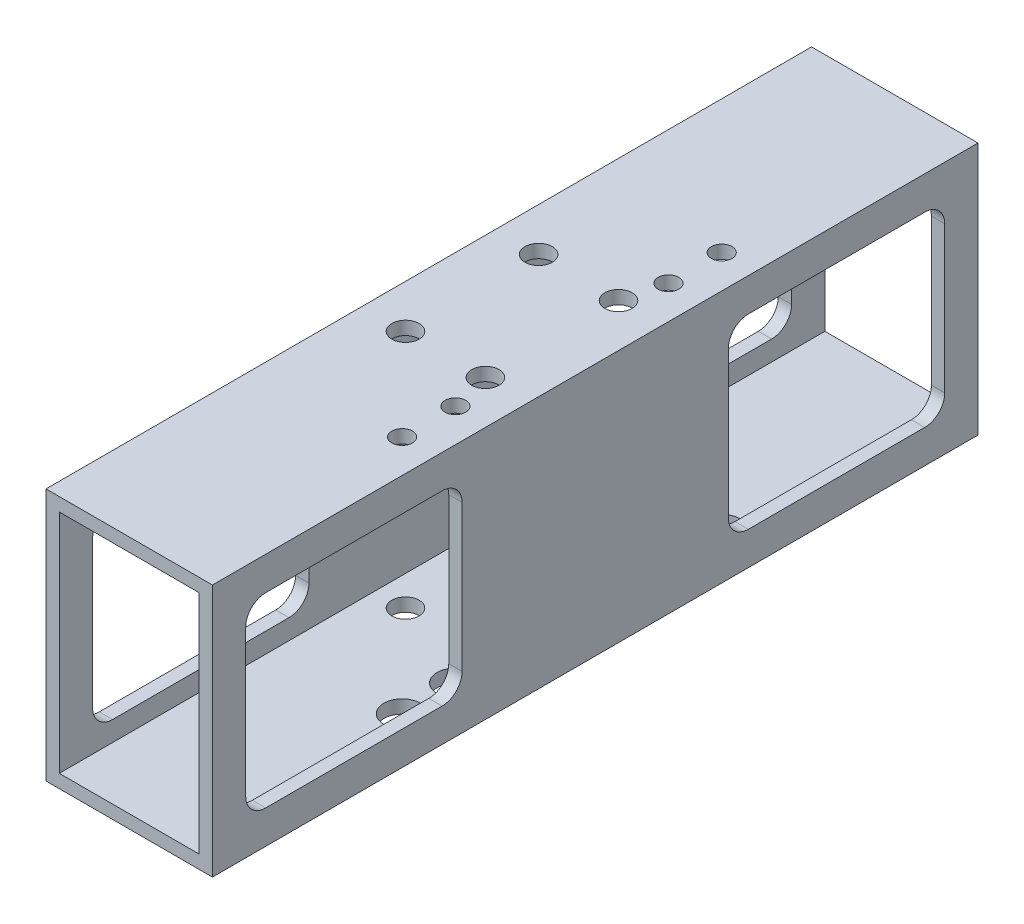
SolidWorks part; units mm, degrees
ref_plane "前视基准面" through (0, 0, 0) normal (0, 0, 1) x (1, 0, 0)
ref_plane "上视基准面" through (0, 0, 0) normal (0, 1, 0) x (1, 0, 0)
ref_plane "右视基准面" through (0, 0, 0) normal (1, 0, 0) x (0, 0, -1)
sketch "草图1" plane through (0, 0, 0) normal (0, 0, 1) x (1, 0, 0)
  line L0 (-10.5, 17) -> (10.5, 17)
  line L1 (-12.5, -19) -> (12.5, -19)
  line L2 (-12.5, -19) -> (-12.5, 19)
  line L3 (-12.5, 19) -> (12.5, 19)
  line L4 (12.5, -19) -> (12.5, 19)
  line L5 (-12.5, -19) -> (12.5, 19) construction
  line L6 (-12.5, 19) -> (12.5, -19) construction
  line L7 (10.5, -17) -> (10.5, 17)
  line L8 (-10.5, -17) -> (10.5, -17)
  line L9 (-10.5, -17) -> (-10.5, 17)
  point P0 (0, 0)
  dimension "D1" = 38
  dimension "D2" = 25
  dimension "D3" = 2
extrude "凸台-拉伸1" add sketch "草图1" along normal blind 115
sketch "草图2" plane through (0, 19, 0) normal (0, 1, 0) x (1, 0, 0)
  line L0 (0, 0) -> (0, -115) construction
  line L1 (12.5, -115) -> (-12.5, -115) construction
  line L2 (-12.5, -57.5) -> (12.5, -57.5) construction
  line L3 (-12.5, -115) -> (-12.5, 0) construction
  line L4 (12.5, -115) -> (12.5, 0) construction
  circle A0 centre (-6, -47.5) radius 2.05
  circle A1 centre (6, -47.5) radius 2.05
  circle A2 centre (6, -67.5) radius 2.05
  circle A3 centre (-6, -67.5) radius 2.05
  dimension "D1" = 4.1
  dimension "D2" = 20
  dimension "D3" = 12
  dimension "D4" = 2
  dimension "D5" = 2
extrude "切除-拉伸1" cut sketch "草图2" against normal blind 135
sketch "草图3" plane through (-12.5, 0, 0) normal (-1, 0, 0) x (0, 0, 1)
  line L0 (0, 0) -> (115, 0) construction
  line L1 (0, 19) -> (0, -19) construction
  line L2 (115, 19) -> (115, -19) construction
  line L3 (77.5, 11) -> (77.5, -11)
  line L4 (8, 14) -> (34.5, 14)
  line L5 (5, 11) -> (5, -11)
  line L6 (57.5, 19) -> (57.5, -19) construction
  line L7 (115, 19) -> (0, 19) construction
  line L8 (115, -19) -> (0, -19) construction
  line L9 (8, -14) -> (34.5, -14)
  line L10 (37.5, 11) -> (37.5, -11)
  line L11 (107, -14) -> (80.5, -14)
  line L12 (110, 11) -> (110, -11)
  line L13 (107, 14) -> (80.5, 14)
  arc A0 (34.5, -14) -> (37.5, -11) centre (34.5, -11) ccw
  arc A1 (5, -11) -> (8, -14) centre (8, -11) ccw
  arc A2 (34.5, 14) -> (37.5, 11) centre (34.5, 11) cw
  arc A3 (8, 14) -> (5, 11) centre (8, 11) ccw
  arc A4 (80.5, 14) -> (77.5, 11) centre (80.5, 11) ccw
  arc A5 (80.5, -14) -> (77.5, -11) centre (80.5, -11) cw
  arc A6 (110, -11) -> (107, -14) centre (107, -11) cw
  arc A7 (107, 14) -> (110, 11) centre (107, 11) cw
  dimension "D2" = 20
  dimension "D3" = 5
  dimension "D5" = 3
  dimension "D1" = 5
  dimension "D4" = 5
extrude "切除-拉伸2" cut sketch "草图3" against normal blind 28
sketch "草图4" plane through (0, -19, 0) normal (0, -1, 0) x (1, 0, 0)
  line L0 (7.5, 115) -> (7.5, 0) construction
  line L1 (-12.5, 115) -> (12.5, 115) construction
  line L2 (-12.5, 0) -> (12.5, 0) construction
  line L3 (-12.5, 57.5) -> (46.0884, 57.5) construction
  line L4 (-12.5, 115) -> (-12.5, 0) construction
  line L5 (12.5, 115) -> (12.5, 0) construction
  circle A0 centre (7.5, 73.5) radius 1.55
  circle A1 centre (7.5, 81.5) radius 1.55
  circle A2 centre (7.5, 33.5) radius 1.55
  circle A3 centre (7.5, 41.5) radius 1.55
  dimension "D2" = 3.1
  dimension "D3" = 8
  dimension "D4" = 16
  dimension "D1" = 5
extrude "切除-拉伸3" cut sketch "草图4" against normal blind 71
sketch "草图5" plane through (0, -19, 0) normal (0, -1, 0) x (1, 0, 0)
  circle A0 centre (7.5, 81.5) radius 2.75
  circle A1 centre (7.5, 73.5) radius 2.75
  circle A2 centre (7.5, 41.5) radius 2.75
  circle A3 centre (7.5, 33.5) radius 2.75
  dimension "D1" = 5.5
extrude "切除-拉伸4" cut sketch "草图5" against normal blind 10
